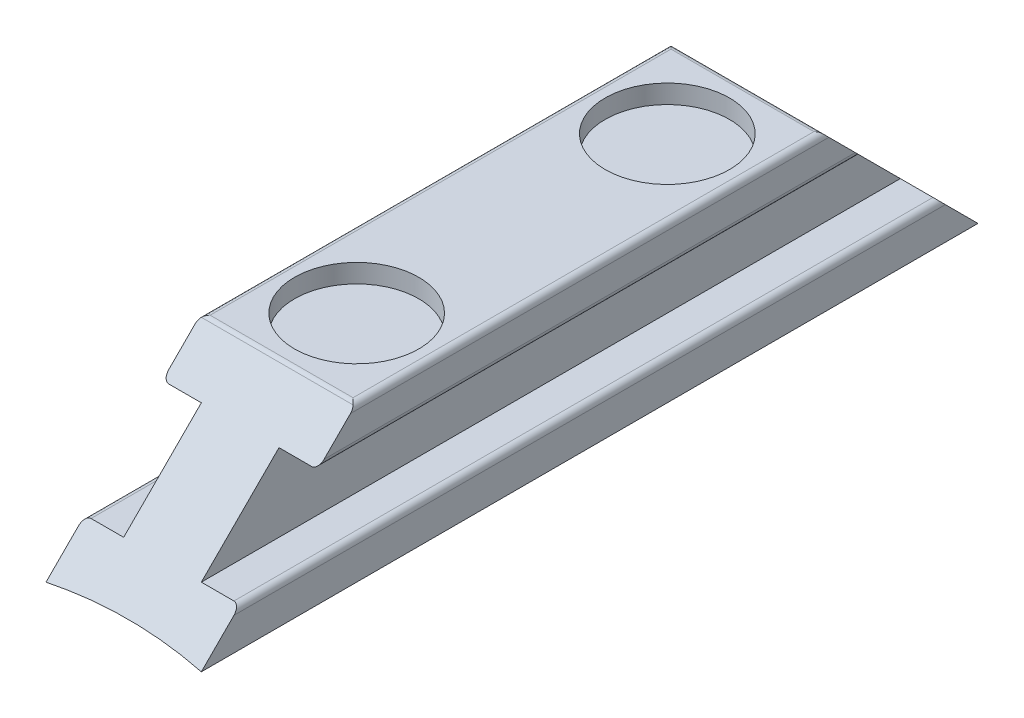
SolidWorks part; units mm, degrees
ref_plane "Front Plane" through (0, 0, 0) normal (0, 0, 1) x (1, 0, 0)
ref_plane "Top Plane" through (0, 0, 0) normal (0, 1, 0) x (1, 0, 0)
ref_plane "Right Plane" through (0, 0, 0) normal (1, 0, 0) x (0, 0, -1)
sketch "Sketch1" plane through (0, 0, 0) normal (0, 0, 1) x (1, 0, 0)
  line L0 (-14.0937, 10.2266) -> (-14.0937, -3.7911) construction
  line L1 (-17.2687, 0) -> (-10.9187, 0)
  line L2 (-17.2687, 4.7625) -> (-17.2687, 6.35)
  line L3 (-17.2687, 6.35) -> (-10.9187, 6.35)
  line L4 (-10.9187, 0) -> (-10.9187, 1.5875)
  line L5 (-17.2687, 1.5875) -> (-15.6812, 1.5875)
  line L7 (-17.2687, 4.7625) -> (-15.6812, 4.7625)
  line L8 (-15.6812, 1.5875) -> (-15.6812, 4.7625)
  line L9 (-12.5062, 1.5875) -> (-12.5062, 4.7625)
  line L10 (-10.9187, 4.7625) -> (-12.5062, 4.7625)
  line L12 (-10.9187, 1.5875) -> (-12.5062, 1.5875)
  line L14 (-17.2687, 1.5875) -> (-17.2687, 0)
  line L15 (-10.9187, 6.35) -> (-10.9187, 4.7625)
  line L18 (-17.2687, 0) -> (-17.2687, 1.5875)
  line L19 (-10.9187, 6.35) -> (-10.9187, 4.7625)
  dimension "D1" = 6.35
  dimension "D2" = 6.35
  dimension "D3" = 6.35
  dimension "D4" = 3.175
  dimension "D5" = 1.5875
  dimension "D6" = 1.5875
extrude "Extrude1" add sketch "Sketch1" along normal blind 31.75 contours L0 L3 L2 L7 L8 L5 L14 L1 | L3 L0 L1 L4 L12 L9 L10 L15
sketch "Sketch2" plane through (-17.2687, 0, 0) normal (-1, 0, 0) x (0, 0, 1)
  line L0 (0, 0) -> (6.35, 6.35)
  line L1 (31.75, 6.35) -> (0, 6.35) construction
  line L2 (6.35, 6.35) -> (25.4, 6.35)
  line L3 (25.4, 6.35) -> (31.75, 0)
  line L4 (31.75, 0) -> (0, 0)
  dimension "D1" = 45
  dimension "D2" = 45
extrude "Cut-Extrude1" cut sketch "Sketch2" against normal blind 101.6 flip side to cut
sketch "Sketch5" plane through (0, 0, 0) normal (0, 0, 1) x (1, 0, 0)
  line L0 (-14.0937, 3.3597) -> (-14.0937, -31.1032) construction
  line L1 (-17.2687, 0) -> (-17.2687, 1.5875) construction
  circle A0 centre (-14.0937, -27.5992) radius 27.7813
  dimension "D2" = 55.5625
  dimension "D1" = 3.175
extrude "Cut-Extrude3" cut sketch "Sketch5" along normal blind 101.6
fillet "Fillet1" radius 0.254 8 edges at (-17.2687, 1.5875, 15.875) (-17.2687, 4.7625, 15.875) (-10.9187, 4.7625, 15.875) (-10.9187, 1.5875, 15.875) (-10.9187, 6.35, 15.875) (-17.2687, 6.35, 15.875) (-14.0937, 6.35, 6.35) (-14.0937, 6.35, 25.4)
sketch "Sketch6" plane through (0, 6.35, 0) normal (0, 1, 0) x (-1, 0, 0)
  line L0 (14.0937, 7.2558) -> (14.0937, 27.7535) construction
  line L1 (10.9187, 6.096) -> (10.9187, 25.654) construction
  line L2 (11.1727, 6.35) -> (17.0147, 6.35) construction
  circle A0 centre (14.0937, 9.525) radius 2.54
  circle A1 centre (14.0937, 22.225) radius 2.54
  dimension "D4" = 5.08
  dimension "D5" = 5.08
  dimension "D1" = 3.175
  dimension "D2" = 12.7
  dimension "D3" = 3.175
extrude "Cut-Extrude4" cut sketch "Sketch6" against normal blind 0.762
